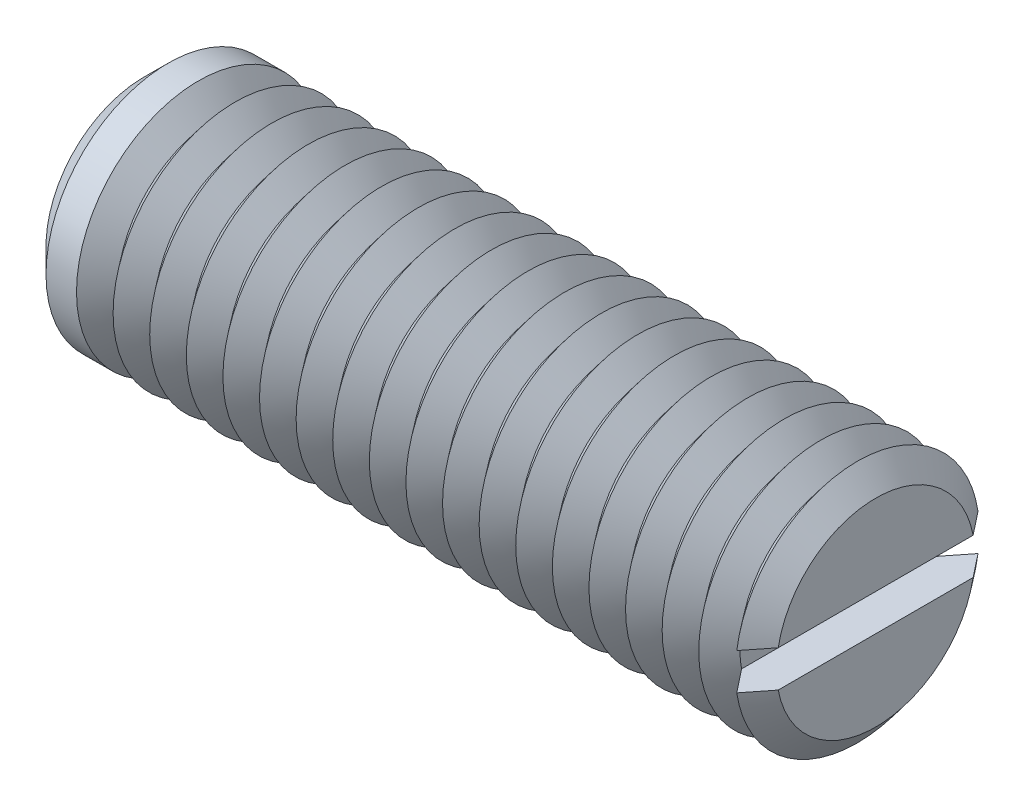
SolidWorks part; units mm, degrees
ref_plane "Front Plane" through (0, 0, 0) normal (0, 0, 1) x (1, 0, 0)
ref_plane "Top Plane" through (0, 0, 0) normal (0, 1, 0) x (1, 0, 0)
ref_plane "Right Plane" through (0, 0, 0) normal (1, 0, 0) x (0, 0, -1)
sketch "Sketch1" plane through (0, 0, 0) normal (1, 0, 0) x (0, 0, -1)
  circle A0 centre (0, 0) radius 5
  dimension "D1" = 10
extrude "Extrude1" add sketch "Sketch1" along normal mid plane 30
sketch "Sketch2" plane through (0, 0, 0) normal (0, 0, 1) x (1, 0, 0)
  line L0 (15, 0.75) -> (13.5, 0.75)
  line L1 (15, -5) -> (15, 5) construction
  line L2 (13.5, 0.75) -> (13.5, -0.75)
  line L3 (0, 0) -> (50000, 0) construction
  line L4 (15, -0.75) -> (13.5, -0.75)
  line L5 (15, -0.75) -> (15, 0.75)
  point P9 (13.5, 0)
  dimension "D1" = 1.5
extrude "Extrude2" cut sketch "Sketch2" against normal mid plane 15
chamfer "Chamfer1" distance 1 angle 45 1 edges at (-15, 0, -5)
sketch "Sketch3" plane through (0, 0, 0) normal (0, 0, 1) x (1, 0, 0)
  line L0 (0, 0) -> (30.9602, 0) construction
  line L1 (14.25, -5) -> (15.75, -5)
  line L2 (-14, -5) -> (15, -5) construction
  line L3 (15.75, -5) -> (15, -4.0633)
  line L4 (15, -5) -> (15, -0.75) construction
  line L5 (15, -4.0633) -> (14.25, -5)
  dimension "D1" = 1.5
  dimension "D2" = 1.2
revolve "Cut-Revolve1" cut sketch "Sketch3" angle 360 about L0
pattern_linear "LPattern1" count 19 spacing 1.5 along (-1, 0, 0) of "Cut-Revolve1"
equation "\"D2@Sketch3\" = \"D1@Sketch3\"*0.8"
